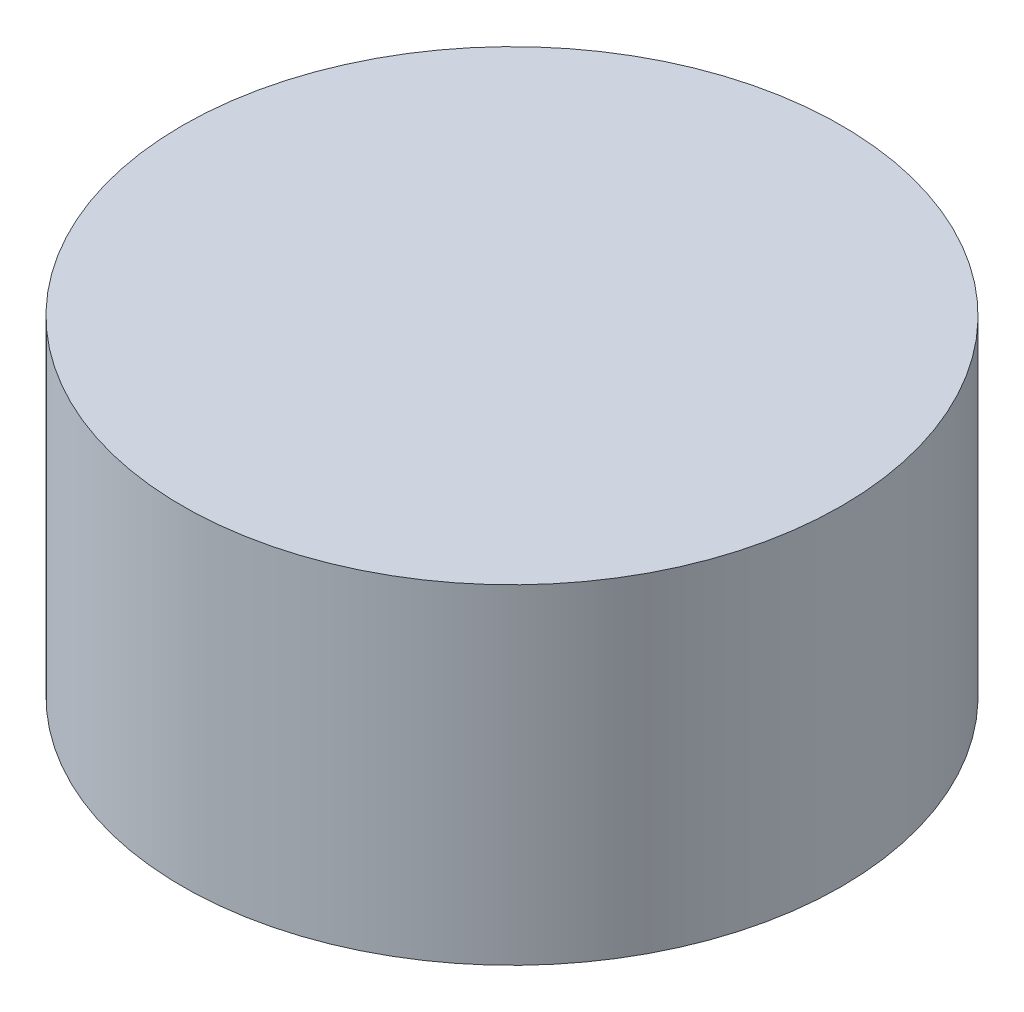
SolidWorks part; units mm, degrees
ref_plane "Front Plane" through (0, 0, 0) normal (0, 0, 1) x (1, 0, 0)
ref_plane "Top Plane" through (0, 0, 0) normal (0, 1, 0) x (1, 0, 0)
ref_plane "Right Plane" through (0, 0, 0) normal (1, 0, 0) x (0, 0, -1)
sketch "Sketch2" plane through (0, 0, 0) normal (0, 0, 1) x (1, 0, 0)
  line L1 (0, 0) -> (50, 0)
  line L2 (0, 0) -> (0, 50)
  line L3 (0, 50) -> (50, 50)
  line L4 (50, 0) -> (50, 50)
  dimension "D1" = 50
  dimension "D2" = 50
revolve "Revolve1" add sketch "Sketch2" angle 360 about L2
sketch "Sketch5" plane through (0, 0, 0) normal (0, 0, 1) x (1, 0, 0)
  line L0 (0, -15) -> (25, 0.1319)
  line L1 (-25, 15.1319) -> (25, 15.1319)
  line L2 (-25, 15.1319) -> (-25, 0)
  line L4 (25, 15.1319) -> (25, 0.1319)
  line L5 (-25, 15.1319) -> (12.391, -7.5) construction
  line L6 (-12.4453, -7.5328) -> (25, 15.1319) construction
  line L7 (0, -15) -> (-25, 0)
  line L8 (0, 0) -> (0, -15) construction
  line L9 (-50, 0) -> (50, 0) construction
  point P0 (0, 0)
  dimension "D1" = 50
  dimension "D2" = 15
  dimension "D3" = 29.2229
  dimension "D4" = 43.7703
  dimension "D5" = 43.7069
extrude "Boss-Extrude1" add sketch "Sketch5" along normal blind 20
sketch "Sketch6" plane through (0, 0, 0) normal (0, 0, 1) x (1, 0, 0)
  line L0 (0, -15) -> (25, 0.1319)
  line L1 (-25, 15.1319) -> (25, 15.1319)
  line L2 (-25, 15.1319) -> (-25, 0)
  line L4 (25, 15.1319) -> (25, 0.1319)
  line L5 (-25, 15.1319) -> (12.391, -7.5) construction
  line L6 (-12.4453, -7.5328) -> (25, 15.1319) construction
  line L7 (0, -15) -> (-25, 0)
  line L8 (0, 0) -> (0, -15) construction
  point P0 (0, 0)
  dimension "D1" = 50
  dimension "D2" = 15
  dimension "D3" = 29.2229
  dimension "D4" = 43.7703
  dimension "D5" = 43.7069
extrude "Boss-Extrude2" add sketch "Sketch6" against normal blind 20
sketch "Sketch9" plane through (0, 0, 0) normal (0, 0, 1) x (1, 0, 0)
  line L0 (0, -15) -> (25, 0.1319)
  line L1 (-25, 15.1319) -> (25, 15.1319)
  line L2 (-25, 15.1319) -> (-25, 0)
  line L4 (25, 15.1319) -> (25, 0.1319)
  line L5 (-25, 15.1319) -> (12.391, -7.5) construction
  line L6 (-12.4453, -7.5328) -> (25, 15.1319) construction
  line L7 (0, -15) -> (-25, 0)
  line L8 (0, 0) -> (0, -15) construction
  point P0 (0, 0)
  dimension "D1" = 50
  dimension "D2" = 15
  dimension "D3" = 29.2229
  dimension "D4" = 43.7703
  dimension "D5" = 43.7069
extrude "Cut-Extrude5" cut sketch "Sketch9" against normal blind 10
sketch "Sketch10" plane through (0, 0, 0) normal (0, 0, 1) x (1, 0, 0)
  line L0 (0, -15) -> (25, 0.1319)
  line L1 (-25, 15.1319) -> (25, 15.1319)
  line L2 (-25, 15.1319) -> (-25, 0)
  line L4 (25, 15.1319) -> (25, 0.1319)
  line L5 (-25, 15.1319) -> (12.391, -7.5) construction
  line L6 (-12.4453, -7.5328) -> (25, 15.1319) construction
  line L7 (0, -15) -> (-25, 0)
  line L8 (0, 0) -> (0, -15) construction
  point P0 (0, 0)
  dimension "D1" = 50
  dimension "D2" = 15
  dimension "D3" = 29.2229
  dimension "D4" = 43.7703
  dimension "D5" = 43.7069
extrude "Cut-Extrude6" cut sketch "Sketch10" along normal blind 10
ref_plane "Plane1" through (0, 0, 10) normal (0, 0, 1) x (1, 0, 0)
sketch "Sketch11" plane through (0, 0, 10) normal (0, 0, 1) x (1, 0, 0)
  line L0 (0, 0) -> (0, -5) construction
  circle A0 centre (0, -5) radius 5
  dimension "D1" = 10
  dimension "D2" = 5
extrude "Boss-Extrude3" add sketch "Sketch11" against normal blind 20
fillet "Fillet1" radius 5 1 edges at (0, -15, 15)
fillet "Fillet2" radius 5 1 edges at (0, -15, -15)
